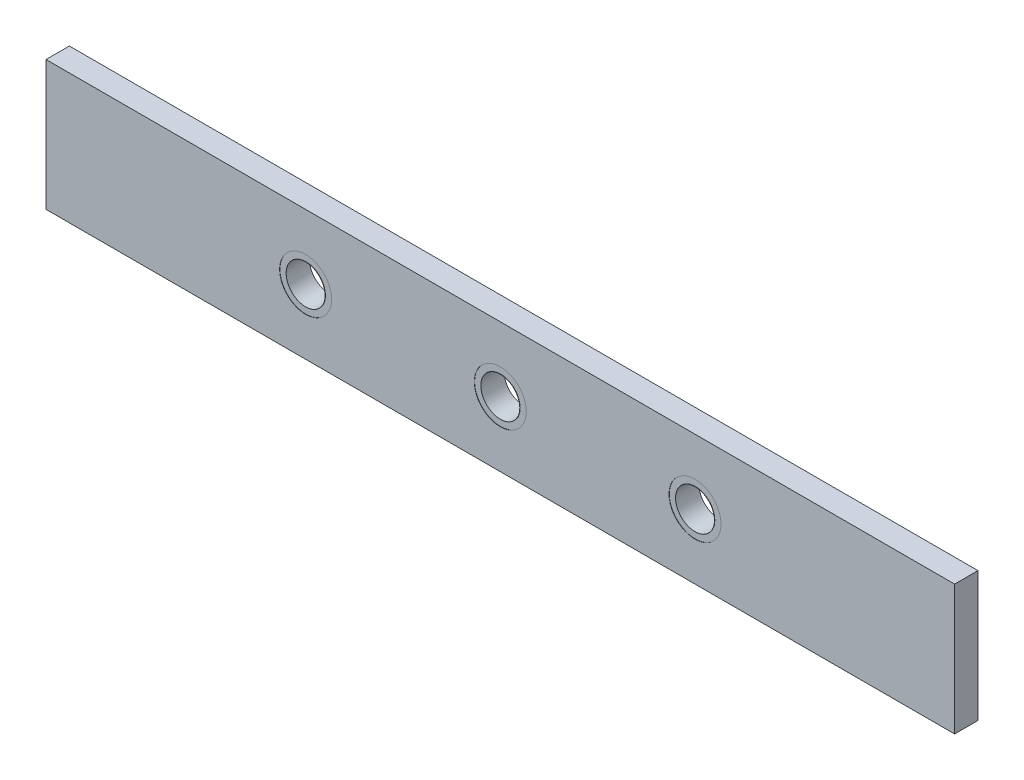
SolidWorks part; units mm, degrees
ref_plane "Front Plane" through (0, 0, 0) normal (0, 0, 1) x (1, 0, 0)
ref_plane "Top Plane" through (0, 0, 0) normal (0, 1, 0) x (1, 0, 0)
ref_plane "Right Plane" through (0, 0, 0) normal (1, 0, 0) x (0, 0, -1)
sketch "Sketch1" plane through (0, 0, 0) normal (0, 0, 1) x (1, 0, 0)
  line L1 (-350, 50) -> (350, 50)
  line L2 (-350, 50) -> (-350, -50)
  line L3 (-350, -50) -> (350, -50)
  line L4 (350, 50) -> (350, -50)
  line L5 (-350, 50) -> (350, -50) construction
  line L6 (-350, -50) -> (350, 50) construction
  point P0 (0, 0)
  dimension "D1" = 700
  dimension "D2" = 100
extrude "Boss-Extrude1" add sketch "Sketch1" along normal blind 18
sketch "Sketch2" plane through (0, 0, 18) normal (0, 0, 1) x (1, 0, 0)
  line L0 (0, 241.7144) -> (0, -339.3607) construction
  line L1 (350, 50) -> (-350, 50) construction
  line L2 (350, -50) -> (350, 50) construction
  circle A0 centre (150, 0) radius 15
  circle A1 centre (-150, 0) radius 15
  dimension "D1" = 30
  dimension "D2" = 50
  dimension "D3" = 200
extrude "Cut-Extrude1" cut sketch "Sketch2" against normal through all
sketch "Sketch4" plane through (0, 0, 18) normal (0, 0, 1) x (1, 0, 0)
  circle A0 centre (0, 0) radius 15
  dimension "D1" = 30
extrude "Cut-Extrude2" cut sketch "Sketch4" against normal through all
sketch "Sketch5" plane through (0, 0, 18) normal (0, 0, 1) x (1, 0, 0)
  circle A0 centre (150, 0) radius 15.05
  circle A1 centre (150, 0) radius 20
  circle A2 centre (0, 0) radius 15.05
  circle A3 centre (0, 0) radius 20
  circle A4 centre (-150, 0) radius 20
  circle A5 centre (-150, 0) radius 15.05
  dimension "D1" = 30.1
  dimension "D2" = 40
  dimension "D3" = 30.1
  dimension "D4" = 40
  dimension "D5" = 30.1
  dimension "D6" = 40
extrude "Cut-Extrude3" cut sketch "Sketch5" against normal blind 0.2
ref_plane "Plane1" through (0, 0, 9) normal (0, 0, 1) x (1, 0, 0)
mirror "Mirror1" about plane through (0, 0, 9) normal (0, 0, 1) of "Cut-Extrude3"
